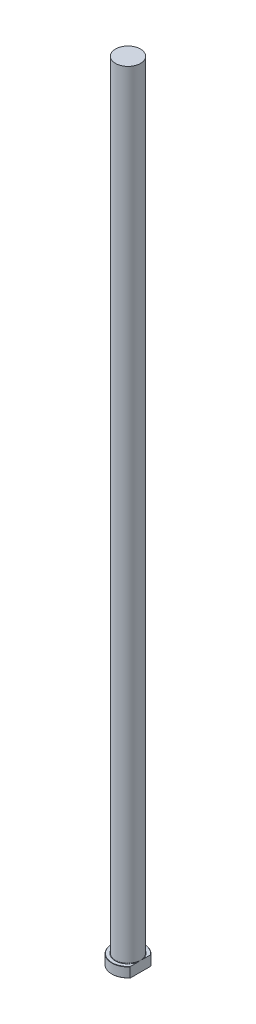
SolidWorks part; units mm, degrees
ref_plane "Front Plane" through (0, 0, 0) normal (0, 0, 1) x (1, 0, 0)
ref_plane "Top Plane" through (0, 0, 0) normal (0, 1, 0) x (1, 0, 0)
ref_plane "Right Plane" through (0, 0, 0) normal (1, 0, 0) x (0, 0, -1)
sketch "Sketch1" plane through (0, 0, 0) normal (0, 0, 1) x (1, 0, 0)
  line L0 (0, 259.9588) -> (0, -15.1925) construction
  line L1 (0, 0) -> (-13, 0)
  line L2 (-13, 0) -> (-13, 8)
  line L3 (-13, 8) -> (-10, 8)
  line L4 (-10, 8) -> (-10, 630)
  line L5 (-10, 630) -> (0, 630)
  line L6 (0, 630) -> (0, 0)
  dimension "L" = 630
  dimension "H" = 26
  dimension "T" = 8
  dimension "D" = 20
revolve "Revolve1" add sketch "Sketch1" angle 360 about L0
chamfer "Chamfer1" distance 0.2 angle 45 2 edges at (0, 8, 13) (0, 0, 13)
fillet "Fillet1" radius 0.3 1 edges at (0, 8, 10)
sketch "Sketch2" plane through (0, 0, 0) normal (0, 1, 0) x (1, 0, 0)
  line L0 (10, 8.3066) -> (10, -8.3066)
  circle A0 centre (0, 0) radius 13 construction
  arc A1 (10, -8.3066) -> (10, 8.3066) centre (0, 0) ccw
  circle A2 centre (0, 0) radius 10 construction
extrude "KEY" cut sketch "Sketch2" along normal through all
